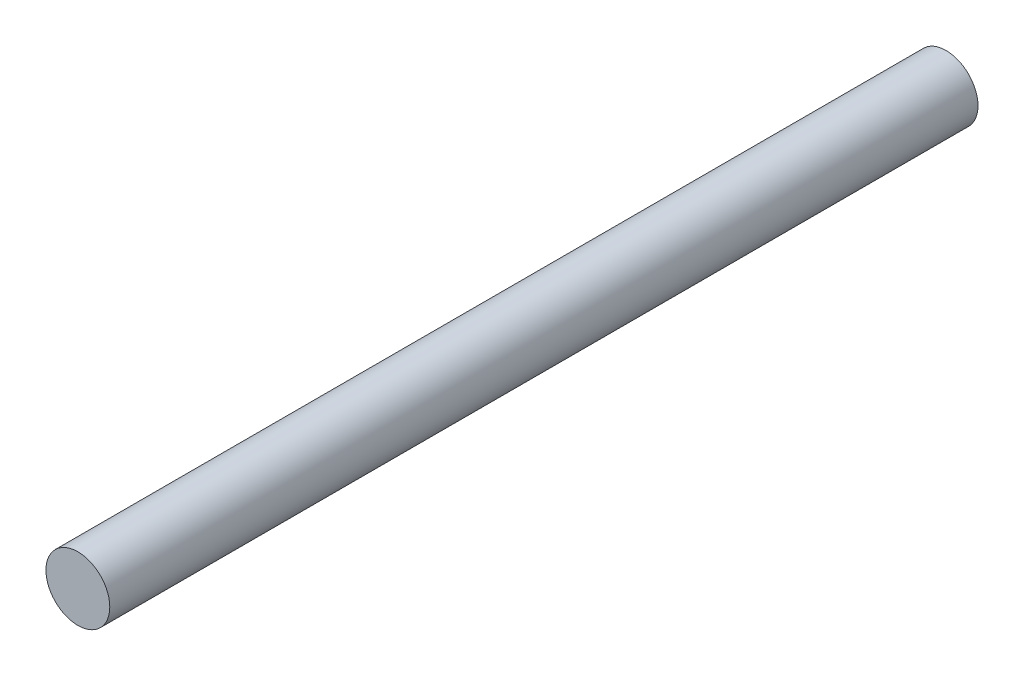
SolidWorks part; units mm, degrees
ref_plane "前视基准面" through (0, 0, 0) normal (0, 0, 1) x (1, 0, 0)
ref_plane "上视基准面" through (0, 0, 0) normal (0, 1, 0) x (1, 0, 0)
ref_plane "右视基准面" through (0, 0, 0) normal (1, 0, 0) x (0, 0, -1)
other "Configuration Table"
sketch "草图1" plane through (0, 0, 0) normal (0, 0, 1) x (1, 0, 0)
  circle A0 centre (0, 0) radius 2.5
extrude "Purchased_steel_shaft_D5_L68_NOT_PRINT" add sketch "草图1" along normal blind 68
